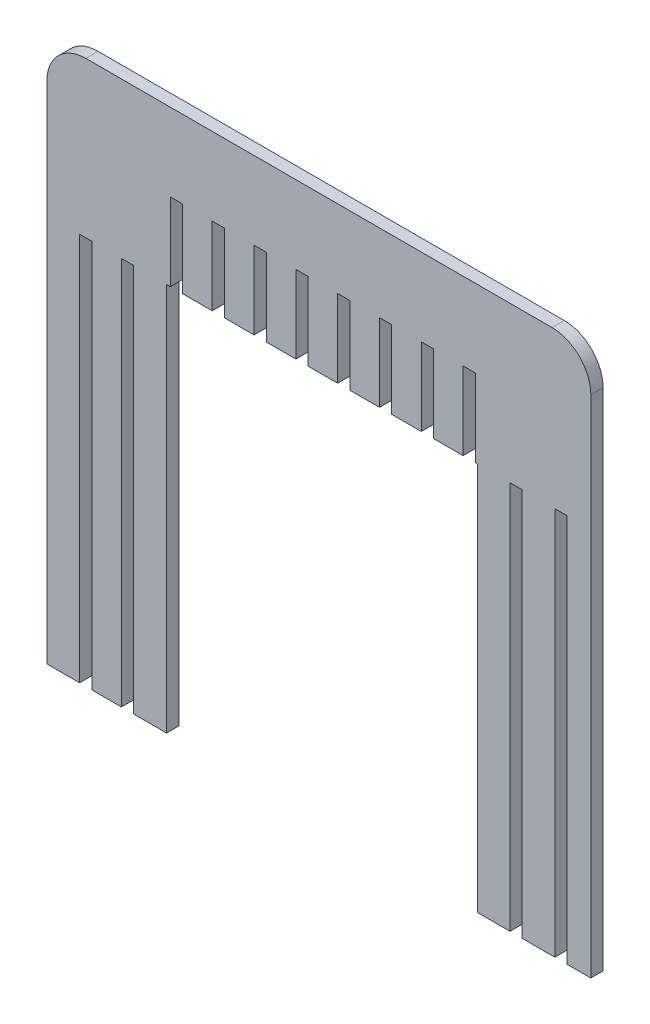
SolidWorks part; units mm, degrees
ref_plane "Front Plane" through (0, 0, 0) normal (0, 0, 1) x (1, 0, 0)
ref_plane "Top Plane" through (0, 0, 0) normal (0, 1, 0) x (1, 0, 0)
ref_plane "Right Plane" through (0, 0, 0) normal (1, 0, 0) x (0, 0, -1)
sketch "Sketch1" plane through (0, 0, 0) normal (0, 0, 1) x (1, 0, 0)
  line L0 (-60.564, -88.9) -> (-49.8, -88.9)
  line L1 (-74.232, -88.9) -> (-64.564, -88.9)
  line L2 (-78.232, -88.9) -> (-78.232, 38.1)
  line L3 (-78.232, 38.1) -> (-74.232, 38.1)
  line L4 (-74.232, -88.9) -> (-74.232, 38.1)
  line L5 (-88.9, 88.9) -> (88.9, -88.9) construction
  line L6 (-88.9, -88.9) -> (88.9, 88.9) construction
  line L7 (-49.8, -88.9) -> (-49.8, 38.1)
  line L8 (-49.8, 38.1) -> (-48.53, 38.1)
  line L9 (51.8, 38.1) -> (51.8, -88.9)
  line L10 (-88.9, -88.9) -> (-78.232, -88.9)
  line L11 (51.8, -88.9) -> (62.468, -88.9)
  line L12 (-88.9, -88.9) -> (-88.9, 88.9)
  line L13 (-88.9, 88.9) -> (88.9, 88.9)
  line L14 (88.9, -88.9) -> (88.9, 88.9)
  line L15 (-64.564, -88.9) -> (-64.564, 38.1)
  line L16 (-64.564, 38.1) -> (-60.564, 38.1)
  line L17 (-60.564, -88.9) -> (-60.564, 38.1)
  line L18 (81.136, -88.9) -> (88.9, -88.9)
  line L19 (66.468, -88.9) -> (77.136, -88.9)
  line L20 (-44.53, 38.1) -> (-34.862, 38.1)
  line L22 (-30.862, 38.1) -> (-21.194, 38.1)
  line L23 (62.468, -88.9) -> (62.468, 38.1)
  line L24 (62.468, 38.1) -> (66.468, 38.1)
  line L25 (66.468, -88.9) -> (66.468, 38.1)
  line L26 (-17.194, 38.1) -> (-7.526, 38.1)
  line L27 (77.136, -88.9) -> (77.136, 38.1)
  line L28 (77.136, 38.1) -> (81.136, 38.1)
  line L29 (81.136, -88.9) -> (81.136, 38.1)
  line L30 (-48.53, 38.1) -> (-48.53, 63.5)
  line L31 (-48.53, 63.5) -> (-44.53, 63.5)
  line L32 (-44.53, 38.1) -> (-44.53, 63.5)
  line L33 (-3.526, 38.1) -> (6.142, 38.1)
  line L34 (-34.862, 38.1) -> (-34.862, 63.5)
  line L35 (-34.862, 63.5) -> (-30.862, 63.5)
  line L36 (-30.862, 38.1) -> (-30.862, 63.5)
  line L37 (10.142, 38.1) -> (19.81, 38.1)
  line L38 (-21.194, 38.1) -> (-21.194, 63.5)
  line L39 (-21.194, 63.5) -> (-17.194, 63.5)
  line L40 (-17.194, 38.1) -> (-17.194, 63.5)
  line L41 (23.81, 38.1) -> (33.478, 38.1)
  line L42 (-7.526, 38.1) -> (-7.526, 63.5)
  line L43 (-7.526, 63.5) -> (-3.526, 63.5)
  line L44 (-3.526, 38.1) -> (-3.526, 63.5)
  line L45 (37.478, 38.1) -> (47.146, 38.1)
  line L46 (6.142, 38.1) -> (6.142, 63.5)
  line L47 (6.142, 63.5) -> (10.142, 63.5)
  line L48 (10.142, 38.1) -> (10.142, 63.5)
  line L49 (51.146, 38.1) -> (51.8, 38.1)
  line L50 (19.81, 38.1) -> (19.81, 63.5)
  line L51 (19.81, 63.5) -> (23.81, 63.5)
  line L52 (23.81, 38.1) -> (23.81, 63.5)
  line L54 (33.478, 38.1) -> (33.478, 63.5)
  line L55 (33.478, 63.5) -> (37.478, 63.5)
  line L56 (37.478, 38.1) -> (37.478, 63.5)
  line L58 (47.146, 38.1) -> (47.146, 63.5)
  line L59 (47.146, 63.5) -> (51.146, 63.5)
  line L60 (51.146, 38.1) -> (51.146, 63.5)
  point P0 (0, 0)
  point P12 (-78.232, -88.9)
  point P13 (-61.564, -88.9)
  point P14 (-75.232, -88.9)
  point P16 (-64.564, -88.9)
extrude "Boss-Extrude1" add sketch "Sketch1" along normal blind 4
fillet "Fillet1" radius 12.7 1 edges at (88.9, 88.9, 2)
fillet "Fillet2" radius 12.7 1 edges at (-88.9, 88.9, 2)
equation "\"major-height\"= 7in"
equation "\"major-teeth-height\"= 5in"
equation "\"minor-height\"= 2in"
equation "\"minor-teeth height\"= 1in"
equation "\"distance-between-teeth\"= 0.42"
equation "\"sheet-thickness\" = 4mm"
equation "\"D1@Sketch1\"=\"major-height\""
equation "\"width\"= 7in"
equation "\"D2@Sketch1\"=\"width\""
equation "\"D3@Sketch1\"=\"major-teeth-height\""
equation "\"D4@Sketch1\"=\"sheet-thickness\""
equation "\"D5@Sketch1\"=\"major-teeth-height\""
equation "\"D6@Sketch1\"=\"sheet-thickness\""
equation "\"D9@Sketch1\"=\"sheet-thickness\""
equation "\"D10@Sketch1\"=\"major-teeth-height\""
equation "\"D11@Sketch1\"=\"sheet-thickness\""
equation "\"D12@Sketch1\"=\"major-teeth-height\""
equation "\"D8@Sketch1\"=\"sheet-thickness\""
equation "\"D13@Sketch1\"=\"minor-teeth height\""
equation "\"D14@Sketch1\"=\"sheet-thickness\""
equation "\"D15@Sketch1\"=\"minor-teeth height\""
equation "\"D16@Sketch1\"=\"sheet-thickness\""
equation "\"D17@Sketch1\"=\"minor-teeth height\""
equation "\"D18@Sketch1\"=\"sheet-thickness\""
equation "\"D19@Sketch1\"=\"minor-teeth height\""
equation "\"D20@Sketch1\"=\"sheet-thickness\""
equation "\"D21@Sketch1\"=\"minor-teeth height\""
equation "\"D22@Sketch1\"=\"sheet-thickness\""
equation "\"D23@Sketch1\"=\"minor-teeth height\""
equation "\"D24@Sketch1\"=\"sheet-thickness\""
equation "\"D25@Sketch1\"=\"minor-teeth height\""
equation "\"D26@Sketch1\"=\"sheet-thickness\""
equation "\"D27@Sketch1\"=\"minor-teeth height\""
equation "\"D1@Boss-Extrude1\"=\"sheet-thickness\""
equation "\"edges\"= 0.5in"
equation "\"D1@Fillet1\"=\"edges\""
equation "\"D1@Fillet2\"=\"edges\""
